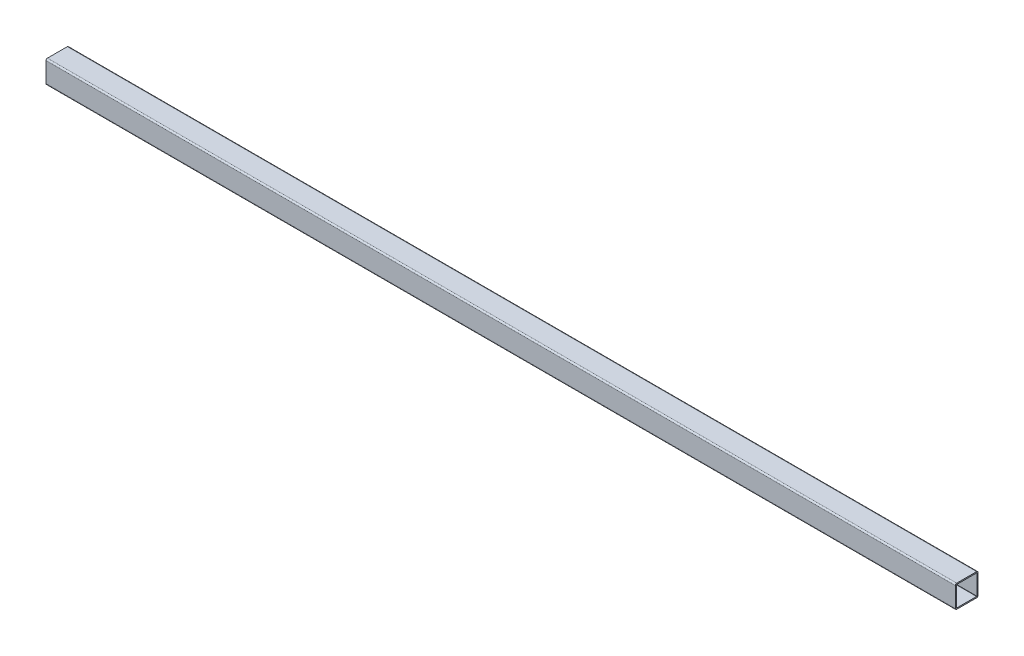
SolidWorks part; units mm, degrees
ref_plane "Front Plane" through (0, 0, 0) normal (0, 0, 1) x (1, 0, 0)
ref_plane "Top Plane" through (0, 0, 0) normal (0, 1, 0) x (1, 0, 0)
ref_plane "Right Plane" through (0, 0, 0) normal (1, 0, 0) x (0, 0, -1)
sketch "Sketch1" plane through (0, 0, 0) normal (1, 0, 0) x (0, 0, -1)
  line L0 (-5.373, 3.898) -> (16.852, 3.898)
  line L1 (-5.373, 5.2442) -> (16.852, 5.2442)
  line L2 (-6.9605, 3.6567) -> (-6.9605, -18.5683)
  line L3 (-5.373, -20.1558) -> (16.852, -20.1558)
  line L4 (18.4395, 3.6567) -> (18.4395, -18.5683)
  line L5 (17.0933, 3.6567) -> (17.0933, -18.5683)
  line L6 (-5.373, -18.8096) -> (16.852, -18.8096)
  line L7 (-5.6143, 3.6567) -> (-5.6143, -18.5683)
  arc A0 (16.852, 5.2442) -> (18.4395, 3.6567) centre (16.852, 3.6567) cw
  arc A1 (-6.9605, 3.6567) -> (-5.373, 5.2442) centre (-5.373, 3.6567) cw
  arc A2 (-5.373, -20.1558) -> (-6.9605, -18.5683) centre (-5.373, -18.5683) cw
  arc A3 (18.4395, -18.5683) -> (16.852, -20.1558) centre (16.852, -18.5683) cw
  arc A4 (16.852, 3.898) -> (17.0933, 3.6567) centre (16.852, 3.6567) cw
  arc A5 (17.0933, -18.5683) -> (16.852, -18.8096) centre (16.852, -18.5683) cw
  arc A6 (-5.373, -18.8096) -> (-5.6143, -18.5683) centre (-5.373, -18.5683) cw
  arc A7 (-5.6143, 3.6567) -> (-5.373, 3.898) centre (-5.373, 3.6567) cw
  point P6 (18.4395, 5.2442)
  point P9 (-6.9605, 5.2442)
  point P14 (18.4395, -20.1558)
  dimension "D3" = 1.5875
  dimension "D1" = 25.4
  dimension "D2" = 25.4
  dimension "D4" = 1.3462
extrude "Extrude1" add sketch "Sketch1" along normal blind 1016
